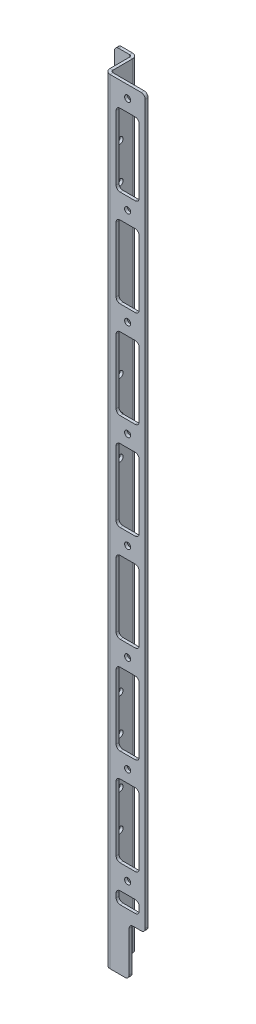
SolidWorks part; units mm, degrees
other "<Unistrut Plastic Slider Rail Vertical>-<Cut-Extrude9>"
ref_plane "Front Plane" through (0, 0, 0) normal (0, 0, 1) x (1, 0, 0)
ref_plane "Top Plane" through (0, 0, 0) normal (0, 1, 0) x (1, 0, 0)
ref_plane "Right Plane" through (0, 0, 0) normal (1, 0, 0) x (0, 0, -1)
mirrored part "Unistrut Plastic Slider Rail Vertical_Mirrored"
